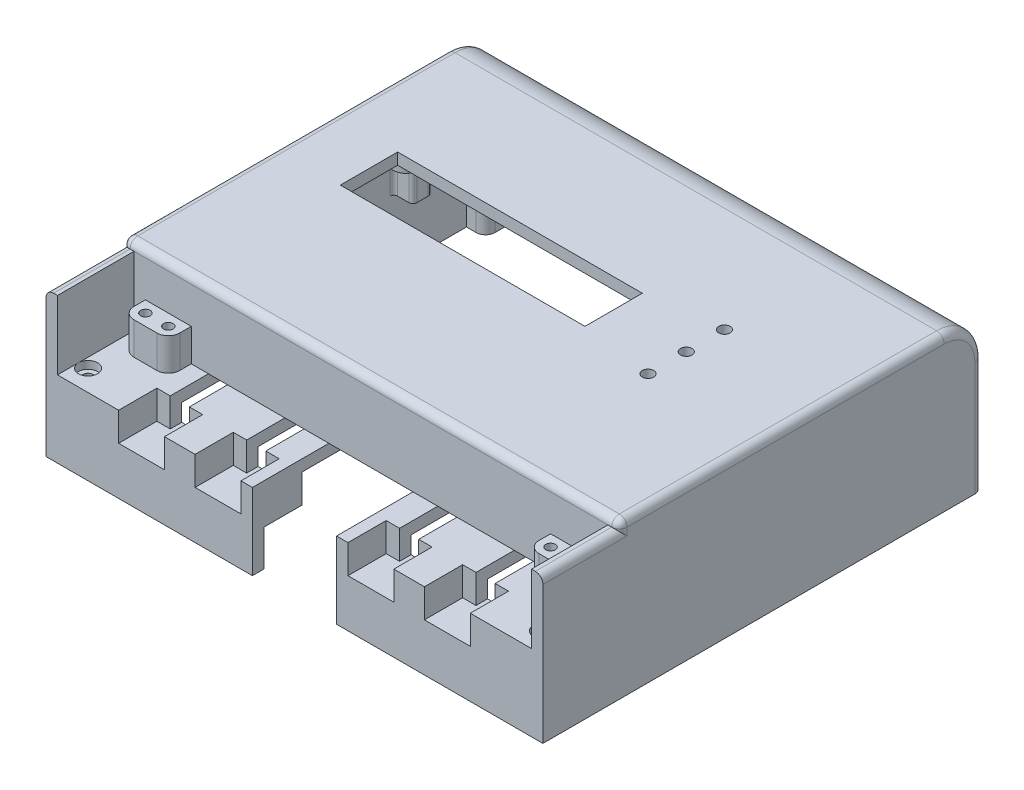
SolidWorks part; units mm, degrees
ref_plane "Front Plane" through (0, 0, 0) normal (0, 0, 1) x (1, 0, 0)
ref_plane "Top Plane" through (0, 0, 0) normal (0, 1, 0) x (1, 0, 0)
ref_plane "Right Plane" through (0, 0, 0) normal (1, 0, 0) x (0, 0, -1)
sketch "Sketch1" plane through (0, 0, 0) normal (0, 1, 0) x (1, 0, 0)
  line L1 (-65, 57.5) -> (65, 57.5)
  line L2 (-65, 57.5) -> (-65, -57.5)
  line L3 (-65, -57.5) -> (65, -57.5)
  line L4 (65, 57.5) -> (65, -57.5)
  line L5 (-65, 57.5) -> (65, -57.5) construction
  line L6 (-65, -57.5) -> (65, 57.5) construction
  point P0 (0, 0)
  dimension "D1" = 130
  dimension "D2" = 115
extrude "Boss-Extrude1" add sketch "Sketch1" along normal blind 40
fillet "Fillet3" radius 10 1 edges at (0, 40, -57.5)
sketch "Sketch6" plane through (0, 40, 0) normal (0, 1, 0) x (1, 0, 0)
  line L0 (65, -57.5) -> (65, 47.5) construction
  line L1 (-65, -57.5) -> (65, -57.5)
  line L2 (-65, -57.5) -> (-65, -37.5)
  line L3 (-65, -37.5) -> (65, -37.5)
  line L4 (65, -57.5) -> (65, -37.5)
  dimension "D1" = 20
extrude "Cut-Extrude4" cut sketch "Sketch6" against normal blind 20
sketch "Sketch11" plane through (0, 0, 57.5) normal (0, 0, 1) x (1, 0, 0)
  line L0 (65, 20) -> (45, 0) construction
  line L1 (-65, 0) -> (65, 0) construction
  line L2 (65, 0) -> (40, 20) construction
  line L3 (-65, 20) -> (65, 20) construction
  point P10 (0, 0)
  point P11 (39.8542, 20)
  dimension "D1" = 45
  dimension "D2" = 25
ref_plane "Plane1" through (25.3659, 31.7073, 0) normal (0.6247, 0.7809, 0) x (-0.7809, 0.6247, 0)
sketch "Sketch12" plane through (25.3659, 31.7073, 0) normal (0.6247, 0.7809, 0) x (-0.7809, 0.6247, 0)
  line L0 (-50.7565, 57.5) -> (-42.3147, 57.5)
  line L2 (-42.3147, 57.5) -> (-42.3147, 4.9412)
  line L3 (-42.3147, 4.9412) -> (-50.7565, -5.9762)
  line L4 (-50.7565, 57.5) -> (-50.7565, -57.5) construction
  line L5 (-50.7565, -5.9762) -> (-50.7565, 57.5)
  line L7 (-50.7565, 57.5) -> (-18.7409, 57.5) construction
  point P3 (-38.1409, 55)
  point P4 (-42.1797, 55)
  point P9 (-31.8198, 55)
  point P10 (-34.7487, 55)
  point P13 (-50.7565, -11.7124)
  point P14 (-43.6099, 3.0908)
  point P15 (-50.7565, -5.9762)
  point P16 (-42.3147, 4.9412)
extrude "Cut-Extrude6" [suppressed] cut sketch "Sketch12" against normal through all both and the other way through all
mirror "Mirror1" [suppressed] about plane through (0, 0, 0) normal (1, 0, 0)
sketch "Sketch14" plane through (0, 20, 0) normal (0, 1, 0) x (1, 0, 0)
  line L7 (-59, -37.5) -> (-47, -37.5)
  line L8 (47, -37.5) -> (59, -37.5)
  line L9 (59, -40.5) -> (59, -37.5)
  line L10 (47, -40.5) -> (47, -37.5)
  line L11 (-47, -40.5) -> (-47, -37.5)
  line L12 (-59, -40.5) -> (-59, -37.5)
  line L13 (-56, -43.5) -> (-50, -43.5)
  line L14 (50, -43.5) -> (56, -43.5)
  line L15 (0, -37.5) -> (0, -57.5) construction
  line L16 (65, -37.5) -> (-65, -37.5) construction
  line L17 (-65, -57.5) -> (65, -57.5) construction
  line L18 (-47, -37.5) -> (47, -37.5) construction
  arc A4 (59, -40.5) -> (56, -43.5) centre (56, -40.5) cw
  arc A5 (50, -43.5) -> (47, -40.5) centre (50, -40.5) cw
  arc A6 (-47, -40.5) -> (-50, -43.5) centre (-50, -40.5) cw
  arc A7 (-56, -43.5) -> (-59, -40.5) centre (-56, -40.5) cw
  circle A8 centre (-56, -40.5) radius 1.25
  circle A9 centre (-50, -40.5) radius 1.25
  circle A10 centre (50, -40.5) radius 1.25
  circle A11 centre (56, -40.5) radius 1.25
  dimension "D1" = 2.5
extrude "Boss-Extrude3" add sketch "Sketch14" along normal blind 8.5 contours A7 L13 A6 L11 L12 A9 A8 M21 | A5 L14 A4 L9 L10 A11 A10 M21
sketch "Sketch15" plane through (0, 20, 0) normal (0, 1, 0) x (1, 0, 0)
  line L0 (65, -37.5) -> (-65, -37.5) construction
  line L29 (-40, -35) -> (-62, -35) construction
  line L30 (-40, -60) -> (-40, -35) construction
  line L31 (40, -69.5) -> (40, -50.5) construction
  line L32 (20, -69.5) -> (20, -50.5) construction
  line L33 (-20, -50.5) -> (-20, -69.5) construction
  line L34 (34, -72.5) -> (46, -47.5) construction
  line L35 (34, -47.5) -> (46, -72.5) construction
  line L36 (14, -72.5) -> (26, -47.5) construction
  line L37 (14, -47.5) -> (26, -72.5) construction
  line L38 (-26, -72.5) -> (-14, -47.5) construction
  line L39 (-26, -47.5) -> (-14, -72.5) construction
  line L40 (-46, -72.5) -> (-34, -47.5) construction
  line L41 (-46, -47.5) -> (-34, -72.5) construction
  line L42 (-40, -69.5) -> (-40, -50.5) construction
  line L43 (46, -47.5) -> (46, -72.5)
  line L44 (34, -72.5) -> (46, -72.5)
  line L45 (34, -47.5) -> (34, -72.5)
  line L46 (34, -47.5) -> (46, -47.5)
  line L47 (26, -47.5) -> (26, -72.5)
  line L48 (14, -72.5) -> (26, -72.5)
  line L49 (14, -47.5) -> (14, -72.5)
  line L50 (14, -47.5) -> (26, -47.5)
  line L51 (-14, -47.5) -> (-14, -72.5)
  line L52 (-26, -72.5) -> (-14, -72.5)
  line L53 (-26, -47.5) -> (-26, -72.5)
  line L54 (-26, -47.5) -> (-14, -47.5)
  line L55 (-34, -47.5) -> (-34, -72.5)
  line L56 (-46, -72.5) -> (-34, -72.5)
  line L57 (-46, -47.5) -> (-46, -72.5)
  line L58 (-46, -47.5) -> (-34, -47.5)
  point P0 (-62, -37.5)
  point P90 (40, -60)
  point P91 (20, -60)
  point P92 (-20, -60)
  point P93 (-40, -60)
  dimension "D1" = 3
extrude "Cut-Extrude7" cut sketch "Sketch15" against normal blind 7.5
fillet "Fillet5" radius 2 6 edges at (65, 15, -57.5) (65, 37.0711, -54.5711) (-65, 15, -57.5) (-65, 37.0711, -54.5711) (65, 40, -5) (-65, 40, -5)
shell "Shell2" thickness 3
sketch "Sketch13" plane through (0, 20, 0) normal (0, 1, 0) x (1, 0, 0)
  line L0 (-65, -57.5) -> (-46, -57.5) construction
  line L1 (-65, -37.5) -> (-62, -37.5)
  line L2 (-65, -37.5) -> (-65, -57.5)
  line L3 (-65, -57.5) -> (-62, -57.5)
  line L4 (-62, -37.5) -> (-62, -57.5)
  line L5 (0, -37.5) -> (0, -57.5) construction
  line L11 (63, -37.5) -> (-63, -37.5) construction
  line L12 (-14, -57.5) -> (14, -57.5) construction
  line L13 (62, -37.5) -> (62, -57.5)
  line L14 (65, -57.5) -> (62, -57.5)
  line L15 (65, -37.5) -> (65, -57.5)
  line L16 (65, -37.5) -> (62, -37.5)
  point P17 (-65, -57.5)
  dimension "D1" = 3
extrude "Boss-Extrude2" add sketch "Sketch13" along normal offset from surface (18 mm away) 2
sketch "Sketch16" plane through (0, 25.5, 0) normal (0, -1, 0) x (1, 0, 0)
  line L0 (50, 36.25) -> (50, 34.5) construction
  line L1 (50, 34.5) -> (56, 34.5) construction
  line L2 (56, 34.5) -> (56, 36.25) construction
  line L3 (-56, 36.25) -> (-56, 34.5) construction
  line L4 (-56, 34.5) -> (-50, 34.5) construction
  line L5 (-50, 34.5) -> (-50, 36.25) construction
  line L6 (50, 36.25) -> (50, 34.5)
  line L7 (50, 34.5) -> (56, 34.5)
  line L8 (56, 34.5) -> (56, 36.25)
  line L9 (-56, 36.25) -> (-56, 34.5)
  line L10 (-56, 34.5) -> (-50, 34.5)
  line L11 (-50, 34.5) -> (-50, 36.25)
  arc A0 (53, 37.4896) -> (56, 36.25) centre (56, 40.5) ccw construction
  arc A1 (50, 36.25) -> (53, 37.4896) centre (50, 40.5) ccw construction
  arc A2 (-53, 37.4896) -> (-50, 36.25) centre (-50, 40.5) ccw construction
  arc A3 (-56, 36.25) -> (-53, 37.4896) centre (-56, 40.5) ccw construction
  arc A4 (53, 37.4896) -> (56, 36.25) centre (56, 40.5) ccw
  arc A5 (50, 36.25) -> (53, 37.4896) centre (50, 40.5) ccw
  arc A6 (-53, 37.4896) -> (-50, 36.25) centre (-50, 40.5) ccw
  arc A7 (-56, 36.25) -> (-53, 37.4896) centre (-56, 40.5) ccw
extrude "Boss-Extrude4" add sketch "Sketch16" along normal up to surface (8.5 mm away)
sketch "Sketch17" plane through (0, 0, 47.5) normal (0, 0, 1) x (1, 0, 0)
  line L0 (-46, 20) -> (-34, 12.5) construction
  line L1 (-34, 12.5) -> (-26, 12.5) construction
  line L2 (-26, 12.5) -> (-14, 20) construction
  line L3 (14, 20) -> (26, 12.5) construction
  line L4 (26, 12.5) -> (34, 12.5) construction
  line L5 (34, 12.5) -> (46, 20) construction
  line L6 (-14, 20) -> (-26, 20) construction
  line L7 (-42.5, 12.5) -> (-37.5, 12.5)
  line L8 (-42.5, 12.5) -> (-42.5, 20)
  line L9 (-42.5, 20) -> (-37.5, 20)
  line L10 (-37.5, 12.5) -> (-37.5, 20)
  line L11 (-42.5, 12.5) -> (-37.5, 20) construction
  line L12 (-42.5, 20) -> (-37.5, 12.5) construction
  line L13 (-17.5, 12.5) -> (-22.5, 12.5)
  line L14 (-17.5, 12.5) -> (-17.5, 20)
  line L15 (-17.5, 20) -> (-22.5, 20)
  line L16 (-22.5, 12.5) -> (-22.5, 20)
  line L17 (-17.5, 12.5) -> (-22.5, 20) construction
  line L18 (-17.5, 20) -> (-22.5, 12.5) construction
  line L19 (47, 20) -> (-47, 20) construction
  line L20 (17.5, 12.5) -> (22.5, 12.5)
  line L21 (17.5, 12.5) -> (17.5, 20)
  line L22 (17.5, 20) -> (22.5, 20)
  line L23 (22.5, 12.5) -> (22.5, 20)
  line L24 (17.5, 12.5) -> (22.5, 20) construction
  line L25 (17.5, 20) -> (22.5, 12.5) construction
  line L26 (46, 20) -> (34, 20) construction
  line L27 (37.5, 12.5) -> (42.5, 12.5)
  line L28 (37.5, 12.5) -> (37.5, 20)
  line L29 (37.5, 20) -> (42.5, 20)
  line L30 (42.5, 12.5) -> (42.5, 20)
  line L31 (37.5, 12.5) -> (42.5, 20) construction
  line L32 (37.5, 20) -> (42.5, 12.5) construction
  arc A0 (-14, 20) -> (14, 20) centre (0, -2.4) cw construction
  point P17 (-40, 16.25)
  point P22 (-20, 16.25)
  point P29 (20, 16.25)
  point P36 (40, 16.25)
  dimension "D1" = 5
  dimension "D2" = 5
  dimension "D3" = 5
  dimension "D4" = 5
extrude "Cut-Extrude8" cut sketch "Sketch17" against normal up to next
sketch "Sketch18" plane through (0, 0, 44.5) normal (0, 0, -1) x (-1, 0, 0)
  line L1 (-31, 17) -> (-29, 17)
  line L2 (-31, 17) -> (-31, 9.5)
  line L3 (-31, 9.5) -> (-29, 9.5)
  line L4 (-29, 17) -> (-29, 9.5)
  line L5 (29, 17) -> (31, 17)
  line L6 (29, 17) -> (29, 9.5)
  line L7 (29, 9.5) -> (31, 9.5)
  line L8 (31, 17) -> (31, 9.5)
extrude "Boss-Extrude5" add sketch "Sketch18" against normal up to next
sketch "Sketch3" plane through (0, 40, 0) normal (0, 1, 0) x (1, 0, 0)
  line L11 (-48, 2.5) -> (16, 2.5)
  line L12 (-48, 2.5) -> (-48, 17.5)
  line L13 (-48, 17.5) -> (16, 17.5)
  line L14 (16, 2.5) -> (16, 17.5)
  line L15 (-48, 2.5) -> (16, 17.5) construction
  line L16 (-48, 17.5) -> (16, 2.5) construction
  point P4 (-16, 10)
  dimension "D3" = 64
  dimension "D4" = 15
  dimension "D5" = 10
  dimension "D6" = 16
extrude "Cut-Extrude2" cut sketch "Sketch3" against normal up to next
sketch "Sketch19" plane through (0, 0, 57.5) normal (0, 0, 1) x (1, 0, 0)
  line L0 (0, 0) -> (0, 20) construction
  line L1 (17.5, 20) -> (-17.5, 20) construction
  line L2 (-7.5, 10) -> (7.5, 10)
  line L3 (-7.5, 10) -> (-7.5, 7) construction
  line L4 (-5.5, 10) -> (-5.5, 7)
  line L5 (-9.5, 10) -> (-9.5, 7)
  line L6 (7.5, 10) -> (7.5, 7) construction
  line L7 (9.5, 10) -> (9.5, 7)
  line L8 (5.5, 10) -> (5.5, 7)
  arc A0 (-5.5, 10) -> (-9.5, 10) centre (-7.5, 10) ccw
  arc A1 (-9.5, 7) -> (-5.5, 7) centre (-7.5, 7) ccw
  arc A2 (9.5, 10) -> (5.5, 10) centre (7.5, 10) ccw
  arc A3 (5.5, 7) -> (9.5, 7) centre (7.5, 7) ccw
  point P5 (-7.5, 8.5)
  point P8 (0, 10)
  point P14 (7.5, 8.5)
  dimension "D2" = 2
  dimension "D3" = 2
  dimension "D1" = 15
  dimension "D4" = 3
extrude "Cut-Extrude9" cut sketch "Sketch19" against normal up to next
sketch "Sketch20" plane through (0, 17, 0) normal (0, -1, 0) x (-1, 0, 0)
  line L0 (65, -57.5) -> (-65, -57.5) construction
  line L1 (11, -57.5) -> (-11, -57.5)
  line L2 (11, -57.5) -> (11, -34.5)
  line L3 (11, -34.5) -> (-11, -34.5)
  line L4 (-11, -57.5) -> (-11, -34.5)
  line L5 (-17.5, -34.5) -> (17.5, -34.5) construction
extrude "Cut-Extrude10" cut sketch "Sketch20" against normal up to surface and the other way through all
sketch "Sketch21" plane through (0, 37, 0) normal (0, -1, 0) x (-1, 0, 0)
  circle A0 centre (-21.6, -5.25) radius 1.5
  circle A1 centre (-21.6, 25.75) radius 1.5
  circle A2 centre (54, 25.75) radius 1.5
  circle A3 centre (54, -5.25) radius 1.5
  circle A4 centre (54, -5.25) radius 3.5
  circle A5 centre (54, 25.75) radius 3.5
  circle A6 centre (-21.6, -5.25) radius 3.5
  circle A7 centre (-21.6, 25.75) radius 3.5
  circle A8 centre (-21.6, 25.75) radius 1.2
  circle A9 centre (-21.6, -5.25) radius 1.2
  circle A10 centre (54, 25.75) radius 1.2
  circle A11 centre (54, -5.25) radius 1.2
  dimension "D1" = 2
  dimension "D2" = 0.3
extrude "Boss-Extrude6" add sketch "Sketch21" along normal blind 6.5 contours A7 A1 | A1 A8 | A5 A2 | A2 A10 | A6 A0 | A0 A9 | A3 A11 | A4 A3
sketch "Sketch22" plane through (0, 17, 0) normal (0, -1, 0) x (1, 0, 0)
  line L1 (-62, 54.5) -> (-57, 54.5)
  line L2 (-62, 54.5) -> (-62, 49.5)
  line L3 (-62, 49.5) -> (-57, 49.5)
  line L4 (-57, 54.5) -> (-57, 49.5)
  line L5 (62, 54.5) -> (57, 54.5)
  line L6 (62, 54.5) -> (62, 49.5)
  line L7 (62, 49.5) -> (57, 49.5)
  line L8 (57, 54.5) -> (57, 49.5)
  circle A0 centre (59.5, 52) radius 1.25
  circle A1 centre (-59.5, 52) radius 1.25
  dimension "D5" = 2.5
  dimension "D6" = 2.5
  dimension "D1" = 5
  dimension "D2" = 5
  dimension "D3" = 5
  dimension "D4" = 5
extrude "Boss-Extrude7" add sketch "Sketch22" along normal through all
sketch "Sketch23" plane through (0, 20, 0) normal (0, 1, 0) x (1, 0, 0)
  circle A6 centre (-59.5, -52) radius 1.25 construction
  circle A7 centre (-59.5, -52) radius 1.25
  circle A8 centre (59.5, -52) radius 2.5
  circle A9 centre (-59.5, -52) radius 2.5
  dimension "D1" = 5
  dimension "D2" = 5
extrude "Cut-Extrude11" cut sketch "Sketch23" against normal blind 2 contours A9 A7 | A7 | A8
sketch "Sketch24" plane through (0, 17, 0) normal (0, -1, 0) x (1, 0, 0)
  circle A1 centre (-59.5, 52) radius 1.25
  circle A2 centre (-59.5, 52) radius 1.25
  circle A3 centre (59.5, 52) radius 1.25
  circle A4 centre (59.5, 52) radius 1.25
  dimension "D1" = 0
  dimension "D2" = 0
extrude "Cut-Extrude12" cut sketch "Sketch24" against normal blind 2
sketch "Sketch26" plane through (0, 0, 0) normal (0, -1, 0) x (1, 0, 0)
  line L0 (-62, -54.5) -> (62, -54.5) construction
  line L1 (-62, -54.5) -> (-62, 49.5) construction
  line L2 (-59.5, -49.5) -> (-62, -49.5)
  line L3 (-62, -54.5) -> (-62, -47.5) construction
  line L4 (-62, -49.5) -> (-62, -54.5)
  line L5 (-62, -54.5) -> (-57, -54.5)
  line L6 (-57, -54.5) -> (-57, -52)
  arc A0 (-57, -52) -> (-59.5, -49.5) centre (-59.5, -52) ccw
  circle A1 centre (-59.5, -52) radius 1.25
  dimension "D1" = 5
  dimension "D2" = 2.5
extrude "Boss-Extrude9" add sketch "Sketch26" against normal up to next
mirror "Mirror2" about plane through (0, 0, 0) normal (1, 0, 0) of "Boss-Extrude9"
sketch "Sketch27" plane through (0, 37, 0) normal (0, -1, 0) x (1, 0, 0)
  line L1 (62, 34.5) -> (57, 34.5)
  line L2 (62, 34.5) -> (62, 29.5)
  line L3 (62, 29.5) -> (57, 29.5)
  line L4 (57, 34.5) -> (57, 29.5)
  line L5 (62, -30.5) -> (57, -30.5)
  line L6 (62, -30.5) -> (62, -35.5)
  line L7 (62, -35.5) -> (57, -35.5)
  line L8 (57, -30.5) -> (57, -35.5)
  line L9 (62, 34.5) -> (62, -47.5) construction
  line L10 (57, 34.5) -> (62, 29.5) construction
  line L11 (57, -30.5) -> (62, -35.5) construction
  circle A0 centre (59.5, 32) radius 1.25
  circle A1 centre (59.5, -33) radius 1.25
  dimension "D4" = 2.5
  dimension "D5" = 2.5
  dimension "D1" = 5
  dimension "D2" = 5
  dimension "D3" = 60
extrude "Boss-Extrude10" add sketch "Sketch27" along normal blind 20
mirror "Mirror3" about plane through (0, 0, 0) normal (1, 0, 0) of "Boss-Extrude10"
fillet "Fillet4" radius 1 28 edges at (59.5, 37, -35.5) (-59.5, 37, -30.5) (-59.5, 37, -35.5) (57, 37, -33) (-57, 37, 32) (57, 27, 29.5) (57, 27, 34.5) (57, 37, 32) (62, 27, 29.5) (59.5, 37, 29.5) (-57, 37, -33) (-57, 27, -30.5) (-57, 27, -35.5) (59.5, 37, -30.5) (62, 27, -30.5) (57, 27, -30.5) (57, 27, -35.5) (62, 27, -35.5) (21.6, 37, -22.25) (-54, 37, -22.25) (-54, 37, 8.75) (21.6, 37, 8.75) (-59.5, 37, 29.5) (-57, 27, 29.5) (-57, 27, 34.5) (-62, 27, 29.5) (-62, 27, -30.5) (-62, 27, -35.5)
fillet "Fillet9" radius 2 2 edges at (65, 38, 47.5) (-65, 38, 47.5)
fillet "Fillet10" radius 2 5 edges at (65, 37, 37.5) (64.4142, 39.4142, 37.5) (-65, 37, 37.5) (-64.4142, 39.4142, 37.5) (0, 40, 37.5)
sketch "Sketch28" plane through (0, 37, 0) normal (0, -1, 0) x (-1, 0, 0)
  line L0 (-35, 0) -> (-35, 20) construction
  circle A0 centre (-35, 0) radius 1.5
  circle A1 centre (-35, 10) radius 1.5
  circle A2 centre (-35, 20) radius 1.5
  dimension "D1" = 3
  dimension "D2" = 3
  dimension "D3" = 3
  dimension "D4" = 20
  dimension "D5" = 10
  dimension "D6" = 35
extrude "Cut-Extrude13" cut sketch "Sketch28" against normal through all
sketch "Sketch29" plane through (0, 37, 0) normal (0, -1, 0) x (1, 0, 0)
  line L0 (35, 0) -> (35, -20) construction
  line L1 (38, 0) -> (38, -20)
  line L2 (32, 0) -> (32, -20)
  arc A0 (38, 0) -> (32, 0) centre (35, 0) ccw
  arc A1 (32, -20) -> (38, -20) centre (35, -20) ccw
  circle A3 centre (35, -20) radius 1.5
  circle A4 centre (35, -20) radius 1.5
  circle A5 centre (35, -10) radius 1.5
  circle A6 centre (35, -10) radius 1.5
  circle A7 centre (35, 0) radius 1.5
  circle A8 centre (35, 0) radius 1.5
  point P4 (35, -10)
  dimension "D1" = 3
  dimension "D2" = 0
  dimension "D3" = 0
  dimension "D4" = 0
extrude "Boss-Extrude11" add sketch "Sketch29" along normal blind 2
fillet "Fillet11" radius 1 4 edges at (35, 37, -23) (32, 37, -10) (35, 37, 3) (38, 37, -10)
